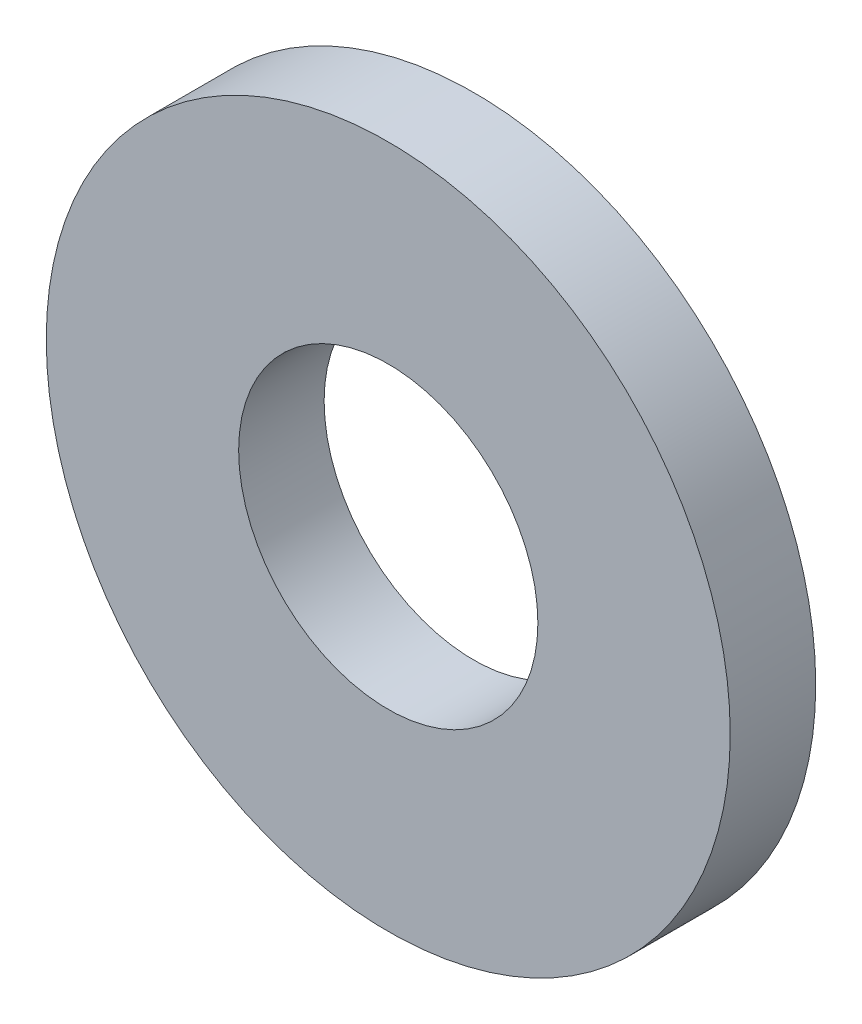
SolidWorks part; units mm, degrees
ref_plane "Plan de face" through (0, 0, 0) normal (0, 0, 1) x (1, 0, 0)
ref_plane "Plan de dessus" through (0, 0, 0) normal (0, 1, 0) x (1, 0, 0)
ref_plane "Plan de droite" through (0, 0, 0) normal (1, 0, 0) x (0, 0, -1)
sketch "Esquisse1" plane through (0, 0, 0) normal (0, 0, 1) x (1, 0, 0)
  circle A0 centre (0, 0) radius 4
  circle A1 centre (0, 0) radius 1.75
  dimension "D1" = 8
  dimension "3.5" = 3.5
extrude "Boss.-Extru.1" add sketch "Esquisse1" along normal blind 1
